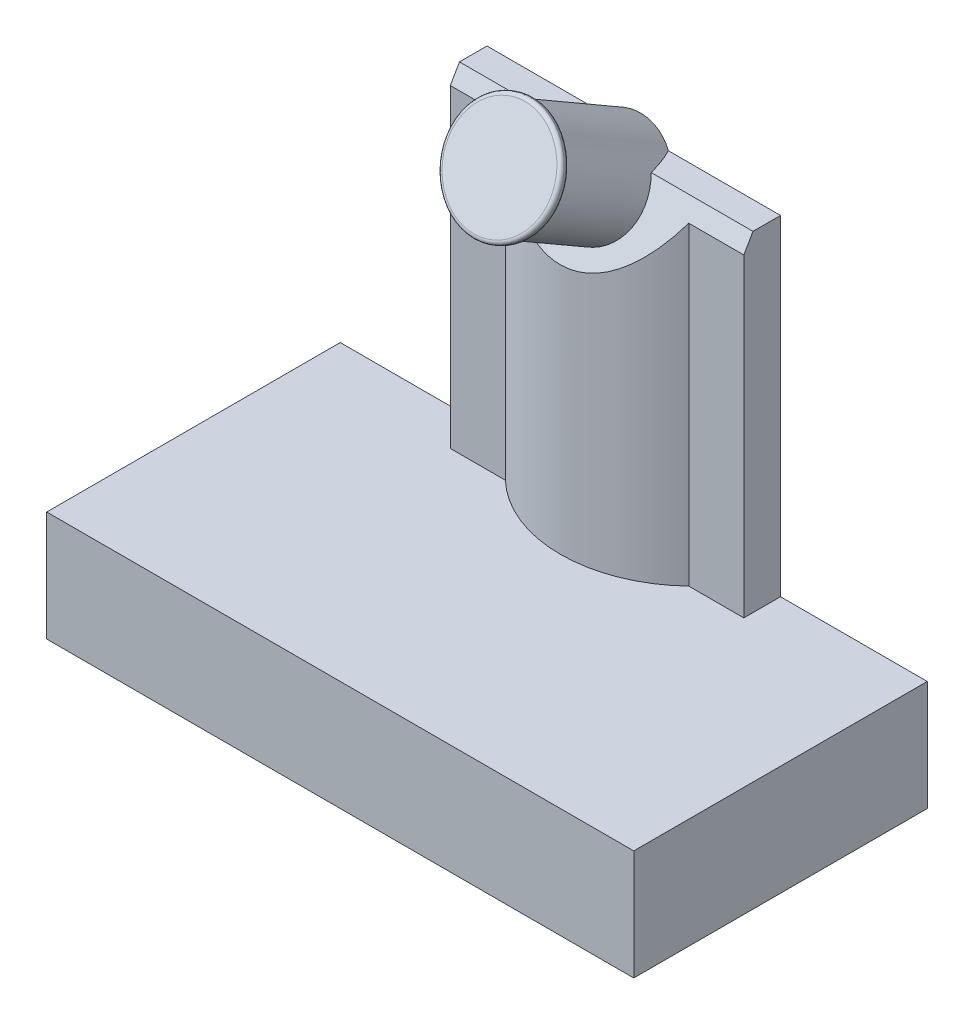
SolidWorks part; units mm, degrees
ref_plane "Face" through (0, 0, 0) normal (0, 0, 1) x (1, 0, 0)
ref_plane "Dessus" through (0, 0, 0) normal (0, 1, 0) x (1, 0, 0)
ref_plane "Droite" through (0, 0, 0) normal (1, 0, 0) x (0, 0, -1)
sketch "Esquisse1" plane through (0, 0, 0) normal (0, 1, 0) x (1, 0, 0)
  line L1 (0, 0) -> (16, 0)
  line L2 (0, 0) -> (0, -8)
  line L3 (0, -8) -> (16, -8)
  line L4 (16, 0) -> (16, -8)
  dimension "D1" = 16
  dimension "D2" = 8
extrude "Base-Extrusion" add sketch "Esquisse1" against normal blind 1
sketch "Esquisse3" plane through (0, -1, 0) normal (0, -1, 0) x (1, 0, 0)
  line L1 (16, 8) -> (0, 8)
  line L2 (16, 8) -> (16, 0)
  line L3 (16, 0) -> (0, 0)
  line L4 (0, 8) -> (0, 0)
  line L5 (1, 1) -> (15, 1)
  line L6 (1, 1) -> (1, 7)
  line L7 (1, 7) -> (15, 7)
  line L8 (15, 1) -> (15, 7)
  dimension "D1" = 1
  dimension "D2" = 1
  dimension "D3" = 6
  dimension "D4" = 14
extrude "Boss.-Extru.1" add sketch "Esquisse3" along normal blind 2
sketch "Esquisse4" plane through (0, -1, 0) normal (0, -1, 0) x (1, 0, 0)
  line L0 (16, 8) -> (0, 8) construction
  line L1 (0, 8) -> (0, 0) construction
  circle A0 centre (8, 4) radius 1.5
  circle A1 centre (8, 4) radius 1
  dimension "D3" = 2
  dimension "D4" = 3
  dimension "D1" = 4
  dimension "D2" = 8
extrude "Boss.-Extru.2" add sketch "Esquisse4" along normal blind 2
sketch "Esquisse5" plane through (0, 0, 0) normal (0, 1, 0) x (-1, 0, 0)
  line L0 (-16, 0) -> (0, 0) construction
  line L1 (-4, 0) -> (-12, 0)
  line L2 (-4, 0) -> (-4, 1)
  line L3 (-4, 1) -> (-5.5, 1)
  line L4 (-12, 0) -> (-12, 1)
  line L5 (-16, 8) -> (-16, 0) construction
  line L6 (0, 0) -> (0, 8) construction
  line L8 (-10.5, 1) -> (-12, 1)
  arc A0 (-5.5, 1) -> (-10.5, 1) centre (-8, -1.625) ccw
  dimension "D1" = 4
  dimension "D2" = 8
  dimension "D3" = 1
  dimension "D4" = 8
  dimension "D6" = 1.5
  dimension "D7" = 1.5
extrude "Boss.-Extru.3" add sketch "Esquisse5" along normal blind 9
chamfer "Chanfrein1" distance 0.25 angle 45 2 edges at (11.25, 9, 1) (4, 4.5, 1)
ref_plane "Plan1" through (0, 2.5748, 4.4596) normal (0, -0.5, -0.866) x (1, 0, 0)
sketch "Esquisse7" plane through (0, 2.5748, 4.4596) normal (0, -0.5, -0.866) x (1, 0, 0)
  line L1 (12.6907, -8.7612) -> (2.5812, -8.7612)
  line L2 (12.6907, -8.7612) -> (12.6907, -3.1885)
  line L3 (12.6907, -3.1885) -> (2.5812, -3.1885)
  line L4 (2.5812, -8.7612) -> (2.5812, -3.1885)
extrude "Enlèv. mat.-Extru.1" cut sketch "Esquisse7" against normal blind 1.2057
ref_plane "Plan2" through (0, 2.25, 3.8971) normal (0, -0.5, -0.866) x (-1, 0, 0)
sketch "Esquisse9" plane through (0, 2.25, 3.8971) normal (0, -0.5, -0.866) x (-1, 0, 0)
  line L0 (-4, 7.7942) -> (-4, 7.4192) construction
  line L1 (-12, 7.7942) -> (-4, 7.7942) construction
  circle A0 centre (-8, 6.7942) radius 1.375
  dimension "D1" = 2.75
  dimension "D2" = 4
  dimension "D3" = 1
extrude "Boss.-Extru.4" add sketch "Esquisse9" against normal up to vertex (0.6495 mm away)
sketch "Esquisse10" plane through (0, 2.5748, 4.4596) normal (0, 0.5, 0.866) x (1, 0, 0)
  line L0 (7.0563, 7.7942) -> (4, 7.7942) construction
  circle A0 centre (8, 6.7942) radius 1.375
  arc A1 (9.2247, 7.4192) -> (6.7753, 7.4192) centre (8, 6.7942) ccw construction
  dimension "D2" = 2.75
  dimension "D1" = 1
extrude "Boss.-Extru.5" add sketch "Esquisse10" along normal blind 3
sketch "Esquisse11" plane through (0, 4.0748, 7.0577) normal (0, 0.5, 0.866) x (1, 0, 0)
  circle A0 centre (8, 6.7942) radius 1.5
  circle A1 centre (8, 6.7942) radius 1.375 construction
  dimension "D1" = 3
extrude "Boss.-Extru.6" add sketch "Esquisse11" against normal blind 0.25
fillet "Congé3" radius 0.1 2 edges at (8, 8.5347, 4.1941) (8, 8.6597, 4.4106)
